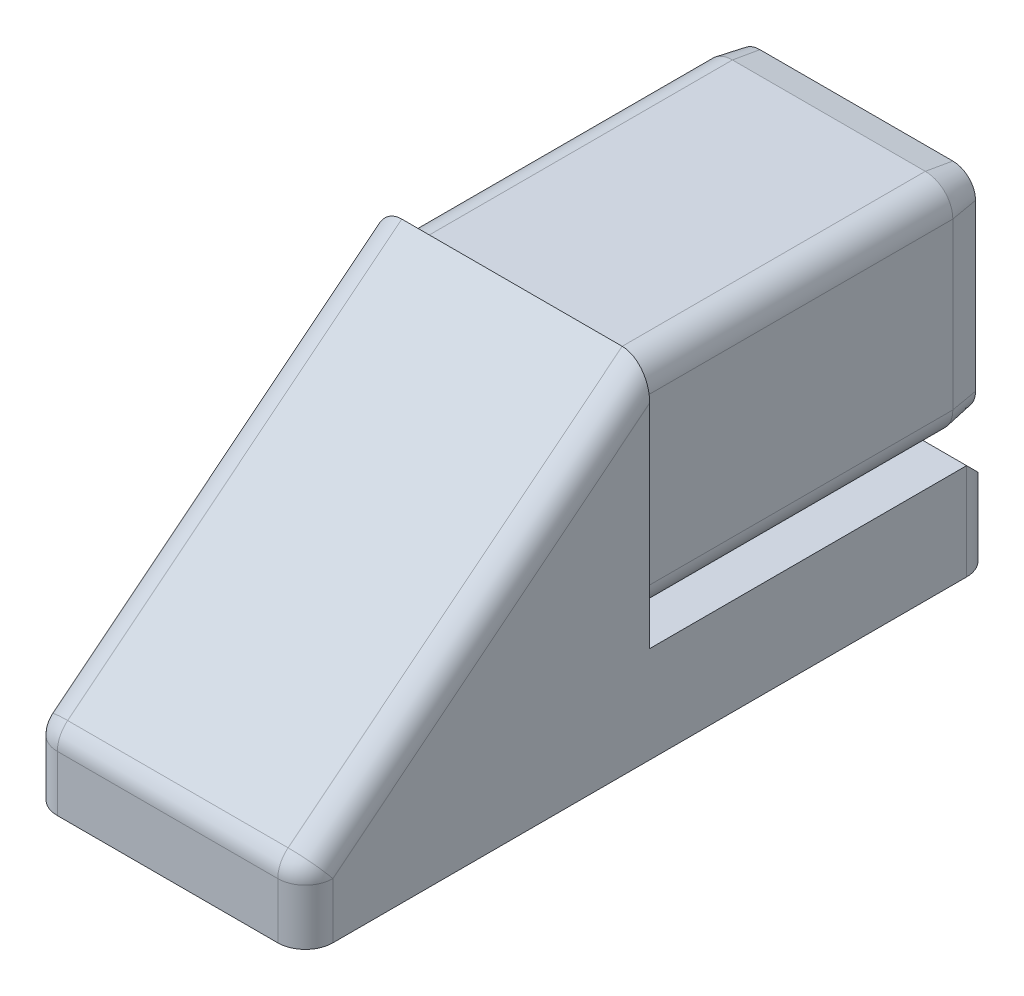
SolidWorks part; units mm, degrees
ref_plane "Plan de face" through (0, 0, 0) normal (0, 0, 1) x (1, 0, 0)
ref_plane "Plan de dessus" through (0, 0, 0) normal (0, 1, 0) x (1, 0, 0)
ref_plane "Plan de droite" through (0, 0, 0) normal (1, 0, 0) x (0, 0, -1)
sketch "Esquisse1" plane through (0, 0, 0) normal (1, 0, 0) x (0, 0, -1)
  line L1 (0, 55) -> (0, -55) construction
  line L2 (0, 20) -> (-50, -20)
  line L3 (-50, -20) -> (-50, -30)
  line L4 (-50, -30) -> (0, -30)
  line L5 (0, -30) -> (0, 20)
  line L6 (55, 0) -> (-55, 0) construction
  dimension "D1" = 20
  dimension "D2" = 30
  dimension "D3" = 20
  dimension "D4" = 50
  dimension "D5" = 38.66
extrude "Boss.-Extru.2" add sketch "Esquisse1" along normal mid plane 40 contours L2 L3 L4 L5
sketch "Esquisse2" plane through (0, 0, 0) normal (0, 0, 1) x (1, 0, 0)
  line L0 (0, -55) -> (0, 55) construction
  line L1 (-14, 18) -> (14, 18)
  line L2 (-18, 14) -> (-18, -14)
  line L4 (18, 14) -> (18, -14)
  line L5 (55, 0) -> (-55, 0) construction
  line L6 (20, -16) -> (20, -30)
  line L7 (20, -30) -> (20, 20) construction
  line L8 (20, -30) -> (-20, -30)
  line L9 (-20, -30) -> (-20, -16)
  line L10 (-20, -30) -> (-20, 20) construction
  line L11 (16, -20) -> (-16, -20)
  line L12 (20, 20) -> (-20, 20) construction
  line L13 (18, -14) -> (-18, -14)
  arc A2 (14, 18) -> (18, 14) centre (14, 14) cw
  arc A3 (-18, 14) -> (-14, 18) centre (-14, 14) cw
  arc A4 (16, -20) -> (20, -16) centre (16, -16) ccw
  arc A5 (-16, -20) -> (-20, -16) centre (-16, -16) cw
  point P4 (0, 18)
  point P7 (-18, 0)
  point P10 (0, -20)
  dimension "D2" = 4
  dimension "D3" = 2
  dimension "D5" = 4
  dimension "D1" = 36
  dimension "D4" = 10
extrude "Boss.-Extru.3" add sketch "Esquisse2" against normal blind 50 contours L11 A5 L9 L8 L6 A4
fillet "Congé1" radius 4 9 edges at (-18, -14, -25) (18, -14, -25) (-20, -23, -50) (20, -23, -50) (-20, -25, 50) (20, -25, 50) (-20, 0, 25) (20, 0, 25) (0, -20, 50)
chamfer "Chanfrein1" distance 4 angle 10 8 edges at (0, -14, -50) (16.8284, -12.8284, -50) (-16.8284, -12.8284, -50) (18, 2, -50) (-18, 2, -50) (16.8284, 16.8284, -50) (-16.8284, 16.8284, -50) (0, 18, -50)
